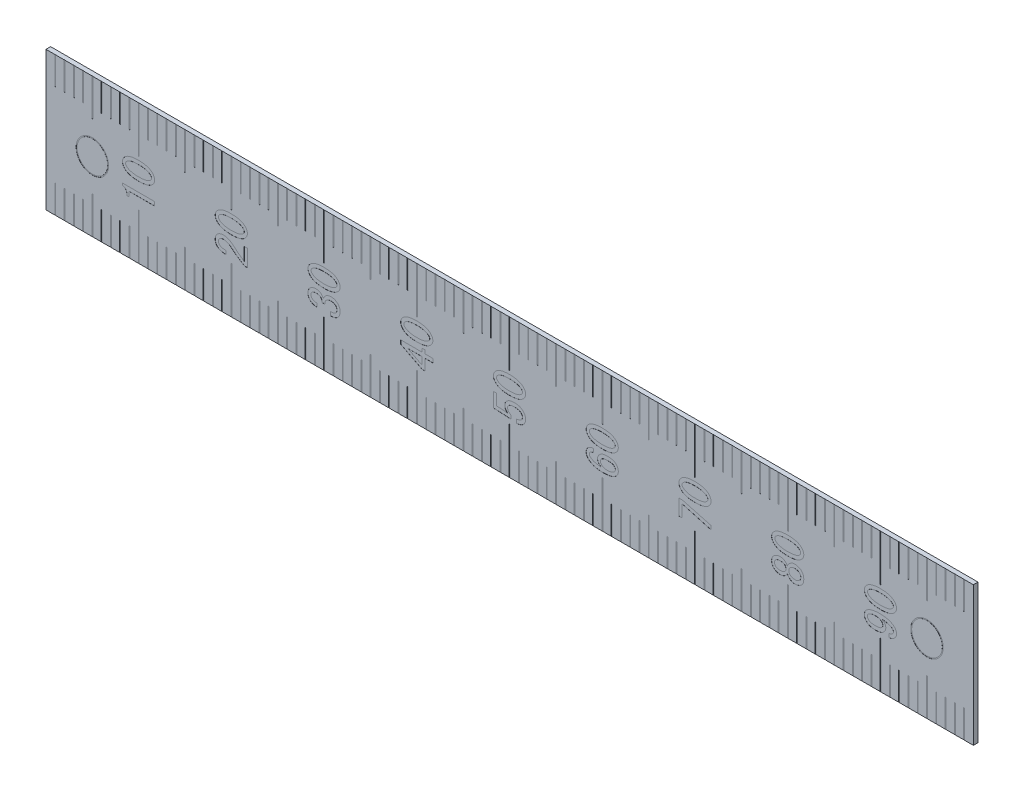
SolidWorks part; units mm, degrees
ref_plane "Front" through (0, 0, 0) normal (0, 0, 1) x (1, 0, 0)
ref_plane "Top" through (0, 0, 0) normal (0, 1, 0) x (1, 0, 0)
ref_plane "Right" through (0, 0, 0) normal (1, 0, 0) x (0, 0, -1)
sketch "Sketch1" plane through (0, 0, 0) normal (0, 0, 1) x (1, 0, 0)
  line L1 (0, -50) -> (0, 50)
  line L2 (0, -50) -> (15, -50)
  line L3 (15, -50) -> (15, 50)
  line L4 (0, 50) -> (15, 50)
  dimension "D1" = 100
  dimension "D2" = 15
extrude "Extrude1" add sketch "Sketch1" along normal blind 0.5
sketch "Sketch2" plane through (0, 0, 0.5) normal (0, 0, 1) x (1, 0, 0)
  line L0 (0, 50) -> (0, -50) construction
  line L1 (0, -50) -> (15, -50) construction
  line L2 (15, 50) -> (0, 50) construction
  circle A0 centre (7.5, -45) radius 1.75
  circle A1 centre (7.5, 45) radius 1.75
  circle A2 centre (7.5, -45) radius 1.65
  circle A3 centre (7.5, 45) radius 1.65
  dimension "D1" = 7.5
  dimension "D2" = 7.5
  dimension "D3" = 5
  dimension "D4" = 5
  dimension "D5" = 3.5
  dimension "D6" = 3.5
  dimension "D7" = 0.1
extrude "Extrude2" cut sketch "Sketch2" against normal blind 0.01
sketch "Sketch3" plane through (0, 0, 0.5) normal (0, 0, 1) x (1, 0, 0)
  line L0 (15, 50) -> (0, 50) construction
  line L1 (5.25, 28.25) -> (9.75, 28.25) construction
  line L2 (5.25, 18.25) -> (9.75, 18.25) construction
  line L3 (5.25, 8.25) -> (9.75, 8.25) construction
  line L5 (0, 50) -> (0, -50) construction
  line L6 (5.25, -1.75) -> (9.75, -1.75) construction
  line L7 (5.25, 38.25) -> (9.75, 38.25) construction
  line L8 (5.25, 38.25) -> (5.25, 41.75) construction
  line L9 (7.5, -50) -> (7.5, 50) construction
  line L10 (0, -50) -> (15, -50) construction
  line L11 (0, 40) -> (15, 40) construction
  line L12 (15, -50) -> (15, 50) construction
  line L13 (5.25, 41.75) -> (9.75, 41.75) construction
  line L14 (9.75, 38.25) -> (9.75, 41.75) construction
  line L15 (5.25, 38.25) -> (9.75, 41.75) construction
  line L16 (5.25, 41.75) -> (9.75, 38.25) construction
  line L17 (5.25, -11.75) -> (9.75, -11.75) construction
  line L18 (5.25, -21.75) -> (9.75, -21.75) construction
  line L19 (5.25, -31.75) -> (9.75, -31.75) construction
  line L20 (5.25, -41.75) -> (9.75, -41.75) construction
  circle A0 centre (7.5, 45) radius 1.75 construction
  text T0 "10" font "ＭＳ ゴシック" height 3.5
  text T1 "20" font "ＭＳ ゴシック" height 3.5
  text T2 "30" font "ＭＳ ゴシック" height 3.5
  text T3 "40" font "ＭＳ ゴシック" height 3.5
  text T4 "50  "
  text T5 "60"
  text T6 "70"
  text T7 "80"
  text T8 "90"
  point P7 (7.5, 40)
  dimension "D2" = 7.5
  dimension "D1" = 4
  dimension "D3" = 6
  dimension "D6" = 10
  dimension "D5" = 4.5
  dimension "D7" = 3.5
extrude "Extrude3" cut sketch "Sketch3" against normal blind 0.01
sketch "Sketch4" plane through (0, 0, 0.5) normal (0, 0, 1) x (1, 0, 0)
  line L0 (15, 40.05) -> (10, 40.05)
  line L1 (15, -50) -> (15, 50) construction
  line L2 (10, 40.05) -> (10, 39.95)
  line L3 (10, 39.95) -> (15, 39.95)
  line L4 (15, 39.95) -> (15, 40.05)
  line L5 (15, 50) -> (0, 50) construction
  line L6 (15, 48.05) -> (15, 47.95)
  line L7 (15, 44.95) -> (11, 44.95)
  line L8 (15, 44.95) -> (15, 45.05)
  line L9 (15, 45.05) -> (11, 45.05)
  line L10 (11, 44.95) -> (11, 45.05)
  line L11 (15, 49.05) -> (12, 49.05)
  line L12 (15, 49.05) -> (15, 48.95)
  line L13 (15, 48.95) -> (12, 48.95)
  line L14 (12, 49.05) -> (12, 48.95)
  line L15 (15, 48.05) -> (12, 48.05)
  line L16 (15, 47.95) -> (12, 47.95)
  line L17 (12, 48.05) -> (12, 47.95)
  line L18 (15, 47.05) -> (15, 46.95)
  line L19 (15, 47.05) -> (12, 47.05)
  line L20 (15, 46.95) -> (12, 46.95)
  line L21 (12, 47.05) -> (12, 46.95)
  line L22 (15, 46.05) -> (15, 45.95)
  line L23 (15, 46.05) -> (12, 46.05)
  line L24 (15, 45.95) -> (12, 45.95)
  line L25 (12, 46.05) -> (12, 45.95)
  line L26 (15, 30.05) -> (10, 30.05)
  line L27 (10, 30.05) -> (10, 29.95)
  line L28 (10, 29.95) -> (15, 29.95)
  line L29 (15, 29.95) -> (15, 30.05)
  line L30 (15, 44.05) -> (15, 43.95)
  line L31 (15, 44.05) -> (12, 44.05)
  line L32 (15, 43.95) -> (12, 43.95)
  line L33 (12, 44.05) -> (12, 43.95)
  line L34 (15, 43.05) -> (15, 42.95)
  line L35 (15, 43.05) -> (12, 43.05)
  line L36 (15, 42.95) -> (12, 42.95)
  line L37 (12, 43.05) -> (12, 42.95)
  line L38 (15, 42.05) -> (15, 41.95)
  line L39 (15, 42.05) -> (12, 42.05)
  line L40 (15, 41.95) -> (12, 41.95)
  line L41 (12, 42.05) -> (12, 41.95)
  line L42 (15, 41.05) -> (15, 40.95)
  line L43 (15, 41.05) -> (12, 41.05)
  line L44 (15, 40.95) -> (12, 40.95)
  line L45 (12, 41.05) -> (12, 40.95)
  line L46 (12, 45.05) -> (12, 44.95)
  line L47 (15, 45.05) -> (12, 45.05)
  line L48 (15, 44.95) -> (12, 44.95)
  line L49 (15, 45.05) -> (15, 44.95)
  line L50 (15, 38.05) -> (15, 37.95)
  line L51 (15, 34.95) -> (11, 34.95)
  line L52 (15, 34.95) -> (15, 35.05)
  line L53 (15, 35.05) -> (11, 35.05)
  line L54 (11, 34.95) -> (11, 35.05)
  line L55 (15, 39.05) -> (12, 39.05)
  line L56 (15, 39.05) -> (15, 38.95)
  line L57 (15, 38.95) -> (12, 38.95)
  line L58 (12, 39.05) -> (12, 38.95)
  line L59 (15, 38.05) -> (12, 38.05)
  line L60 (15, 37.95) -> (12, 37.95)
  line L61 (12, 38.05) -> (12, 37.95)
  line L62 (15, 37.05) -> (15, 36.95)
  line L63 (15, 37.05) -> (12, 37.05)
  line L64 (15, 36.95) -> (12, 36.95)
  line L65 (12, 37.05) -> (12, 36.95)
  line L66 (15, 36.05) -> (15, 35.95)
  line L67 (15, 36.05) -> (12, 36.05)
  line L68 (15, 35.95) -> (12, 35.95)
  line L69 (12, 36.05) -> (12, 35.95)
  line L70 (15, 34.05) -> (15, 33.95)
  line L71 (15, 34.05) -> (12, 34.05)
  line L72 (15, 33.95) -> (12, 33.95)
  line L73 (12, 34.05) -> (12, 33.95)
  line L74 (15, 33.05) -> (15, 32.95)
  line L75 (15, 33.05) -> (12, 33.05)
  line L76 (15, 32.95) -> (12, 32.95)
  line L77 (12, 33.05) -> (12, 32.95)
  line L78 (15, 32.05) -> (15, 31.95)
  line L79 (15, 32.05) -> (12, 32.05)
  line L80 (15, 31.95) -> (12, 31.95)
  line L81 (12, 32.05) -> (12, 31.95)
  line L82 (15, 31.05) -> (15, 30.95)
  line L83 (15, 31.05) -> (12, 31.05)
  line L84 (15, 30.95) -> (12, 30.95)
  line L85 (12, 31.05) -> (12, 30.95)
  line L86 (15, 20.05) -> (10, 20.05)
  line L87 (10, 20.05) -> (10, 19.95)
  line L88 (10, 19.95) -> (15, 19.95)
  line L89 (15, 19.95) -> (15, 20.05)
  line L90 (15, 28.05) -> (15, 27.95)
  line L91 (15, 24.95) -> (11, 24.95)
  line L92 (15, 24.95) -> (15, 25.05)
  line L93 (15, 25.05) -> (11, 25.05)
  line L94 (11, 24.95) -> (11, 25.05)
  line L95 (15, 29.05) -> (12, 29.05)
  line L96 (15, 29.05) -> (15, 28.95)
  line L97 (15, 28.95) -> (12, 28.95)
  line L98 (12, 29.05) -> (12, 28.95)
  line L99 (15, 28.05) -> (12, 28.05)
  line L100 (15, 27.95) -> (12, 27.95)
  line L101 (12, 28.05) -> (12, 27.95)
  line L102 (15, 27.05) -> (15, 26.95)
  line L103 (15, 27.05) -> (12, 27.05)
  line L104 (15, 26.95) -> (12, 26.95)
  line L105 (12, 27.05) -> (12, 26.95)
  line L106 (15, 26.05) -> (15, 25.95)
  line L107 (15, 26.05) -> (12, 26.05)
  line L108 (15, 25.95) -> (12, 25.95)
  line L109 (12, 26.05) -> (12, 25.95)
  line L110 (15, 24.05) -> (15, 23.95)
  line L111 (15, 24.05) -> (12, 24.05)
  line L112 (15, 23.95) -> (12, 23.95)
  line L113 (12, 24.05) -> (12, 23.95)
  line L114 (15, 23.05) -> (15, 22.95)
  line L115 (15, 23.05) -> (12, 23.05)
  line L116 (15, 22.95) -> (12, 22.95)
  line L117 (12, 23.05) -> (12, 22.95)
  line L118 (15, 22.05) -> (15, 21.95)
  line L119 (15, 22.05) -> (12, 22.05)
  line L120 (15, 21.95) -> (12, 21.95)
  line L121 (12, 22.05) -> (12, 21.95)
  line L122 (15, 21.05) -> (15, 20.95)
  line L123 (15, 21.05) -> (12, 21.05)
  line L124 (15, 20.95) -> (12, 20.95)
  line L125 (12, 21.05) -> (12, 20.95)
  line L126 (15, 10.05) -> (10, 10.05)
  line L127 (10, 10.05) -> (10, 9.95)
  line L128 (10, 9.95) -> (15, 9.95)
  line L129 (15, 9.95) -> (15, 10.05)
  line L130 (15, 18.05) -> (15, 17.95)
  line L131 (15, 14.95) -> (11, 14.95)
  line L132 (15, 14.95) -> (15, 15.05)
  line L133 (15, 15.05) -> (11, 15.05)
  line L134 (11, 14.95) -> (11, 15.05)
  line L135 (15, 19.05) -> (12, 19.05)
  line L136 (15, 19.05) -> (15, 18.95)
  line L137 (15, 18.95) -> (12, 18.95)
  line L138 (12, 19.05) -> (12, 18.95)
  line L139 (15, 18.05) -> (12, 18.05)
  line L140 (15, 17.95) -> (12, 17.95)
  line L141 (12, 18.05) -> (12, 17.95)
  line L142 (15, 17.05) -> (15, 16.95)
  line L143 (15, 17.05) -> (12, 17.05)
  line L144 (15, 16.95) -> (12, 16.95)
  line L145 (12, 17.05) -> (12, 16.95)
  line L146 (15, 16.05) -> (15, 15.95)
  line L147 (15, 16.05) -> (12, 16.05)
  line L148 (15, 15.95) -> (12, 15.95)
  line L149 (12, 16.05) -> (12, 15.95)
  line L150 (15, 14.05) -> (15, 13.95)
  line L151 (15, 14.05) -> (12, 14.05)
  line L152 (15, 13.95) -> (12, 13.95)
  line L153 (12, 14.05) -> (12, 13.95)
  line L154 (15, 13.05) -> (15, 12.95)
  line L155 (15, 13.05) -> (12, 13.05)
  line L156 (15, 12.95) -> (12, 12.95)
  line L157 (12, 13.05) -> (12, 12.95)
  line L158 (15, 12.05) -> (15, 11.95)
  line L159 (15, 12.05) -> (12, 12.05)
  line L160 (15, 11.95) -> (12, 11.95)
  line L161 (12, 12.05) -> (12, 11.95)
  line L162 (15, 11.05) -> (15, 10.95)
  line L163 (15, 11.05) -> (12, 11.05)
  line L164 (15, 10.95) -> (12, 10.95)
  line L165 (12, 11.05) -> (12, 10.95)
  line L166 (7.5, 50) -> (7.5, 36.693) construction
  line L167 (3, 1.05) -> (3, 0.95)
  line L168 (0, 0.95) -> (3, 0.95)
  line L169 (0, 1.05) -> (3, 1.05)
  line L170 (15, 8.05) -> (15, 7.95)
  line L171 (15, 4.95) -> (11, 4.95)
  line L172 (15, 4.95) -> (15, 5.05)
  line L173 (15, 5.05) -> (11, 5.05)
  line L174 (11, 4.95) -> (11, 5.05)
  line L175 (15, 9.05) -> (12, 9.05)
  line L176 (15, 9.05) -> (15, 8.95)
  line L177 (15, 8.95) -> (12, 8.95)
  line L178 (12, 9.05) -> (12, 8.95)
  line L179 (15, 8.05) -> (12, 8.05)
  line L180 (15, 7.95) -> (12, 7.95)
  line L181 (12, 8.05) -> (12, 7.95)
  line L182 (15, 7.05) -> (15, 6.95)
  line L183 (15, 7.05) -> (12, 7.05)
  line L184 (15, 6.95) -> (12, 6.95)
  line L185 (12, 7.05) -> (12, 6.95)
  line L186 (15, 6.05) -> (15, 5.95)
  line L187 (15, 6.05) -> (12, 6.05)
  line L188 (15, 5.95) -> (12, 5.95)
  line L189 (12, 6.05) -> (12, 5.95)
  line L190 (15, 4.05) -> (15, 3.95)
  line L191 (15, 4.05) -> (12, 4.05)
  line L192 (15, 3.95) -> (12, 3.95)
  line L193 (12, 4.05) -> (12, 3.95)
  line L194 (15, 3.05) -> (15, 2.95)
  line L195 (15, 3.05) -> (12, 3.05)
  line L196 (15, 2.95) -> (12, 2.95)
  line L197 (12, 3.05) -> (12, 2.95)
  line L198 (15, 2.05) -> (15, 1.95)
  line L199 (15, 2.05) -> (12, 2.05)
  line L200 (15, 1.95) -> (12, 1.95)
  line L201 (12, 2.05) -> (12, 1.95)
  line L202 (15, 1.05) -> (15, 0.95)
  line L203 (15, 1.05) -> (12, 1.05)
  line L204 (15, 0.95) -> (12, 0.95)
  line L205 (12, 1.05) -> (12, 0.95)
  line L206 (15, 0.05) -> (10, 0.05)
  line L207 (10, 0.05) -> (10, -0.05)
  line L208 (10, -0.05) -> (15, -0.05)
  line L209 (15, -0.05) -> (15, 0.05)
  line L210 (0, 1.05) -> (0, 0.95)
  line L211 (3, 2.05) -> (3, 1.95)
  line L212 (0, 1.95) -> (3, 1.95)
  line L213 (0, 2.05) -> (3, 2.05)
  line L214 (0, 2.05) -> (0, 1.95)
  line L215 (3, 3.05) -> (3, 2.95)
  line L216 (0, 2.95) -> (3, 2.95)
  line L217 (0, 3.05) -> (3, 3.05)
  line L218 (0, 3.05) -> (0, 2.95)
  line L219 (3, 4.05) -> (3, 3.95)
  line L220 (0, 3.95) -> (3, 3.95)
  line L221 (0, 4.05) -> (3, 4.05)
  line L222 (0, 4.05) -> (0, 3.95)
  line L223 (3, 6.05) -> (3, 5.95)
  line L224 (0, 5.95) -> (3, 5.95)
  line L225 (0, 6.05) -> (3, 6.05)
  line L226 (0, 6.05) -> (0, 5.95)
  line L227 (3, 7.05) -> (3, 6.95)
  line L228 (0, 6.95) -> (3, 6.95)
  line L229 (0, 7.05) -> (3, 7.05)
  line L230 (0, 7.05) -> (0, 6.95)
  line L231 (3, 8.05) -> (3, 7.95)
  line L232 (0, 7.95) -> (3, 7.95)
  line L233 (0, 8.05) -> (3, 8.05)
  line L234 (3, 9.05) -> (3, 8.95)
  line L235 (0, 8.95) -> (3, 8.95)
  line L236 (0, 9.05) -> (0, 8.95)
  line L237 (0, 9.05) -> (3, 9.05)
  line L238 (4, 4.95) -> (4, 5.05)
  line L239 (0, 5.05) -> (4, 5.05)
  line L240 (0, 4.95) -> (0, 5.05)
  line L241 (0, 4.95) -> (4, 4.95)
  line L242 (0, 8.05) -> (0, 7.95)
  line L243 (3, 11.05) -> (3, 10.95)
  line L244 (0, 10.95) -> (3, 10.95)
  line L245 (0, 11.05) -> (3, 11.05)
  line L246 (0, 11.05) -> (0, 10.95)
  line L247 (3, 12.05) -> (3, 11.95)
  line L248 (0, 11.95) -> (3, 11.95)
  line L249 (0, 12.05) -> (3, 12.05)
  line L250 (0, 12.05) -> (0, 11.95)
  line L251 (3, 13.05) -> (3, 12.95)
  line L252 (0, 12.95) -> (3, 12.95)
  line L253 (0, 13.05) -> (3, 13.05)
  line L254 (0, 13.05) -> (0, 12.95)
  line L255 (3, 14.05) -> (3, 13.95)
  line L256 (0, 13.95) -> (3, 13.95)
  line L257 (0, 14.05) -> (3, 14.05)
  line L258 (0, 14.05) -> (0, 13.95)
  line L259 (3, 16.05) -> (3, 15.95)
  line L260 (0, 15.95) -> (3, 15.95)
  line L261 (0, 16.05) -> (3, 16.05)
  line L262 (0, 16.05) -> (0, 15.95)
  line L263 (3, 17.05) -> (3, 16.95)
  line L264 (0, 16.95) -> (3, 16.95)
  line L265 (0, 17.05) -> (3, 17.05)
  line L266 (0, 17.05) -> (0, 16.95)
  line L267 (3, 18.05) -> (3, 17.95)
  line L268 (0, 17.95) -> (3, 17.95)
  line L269 (0, 18.05) -> (3, 18.05)
  line L270 (3, 19.05) -> (3, 18.95)
  line L271 (0, 18.95) -> (3, 18.95)
  line L272 (0, 19.05) -> (0, 18.95)
  line L273 (0, 19.05) -> (3, 19.05)
  line L274 (4, 14.95) -> (4, 15.05)
  line L275 (0, 15.05) -> (4, 15.05)
  line L276 (0, 14.95) -> (0, 15.05)
  line L277 (0, 14.95) -> (4, 14.95)
  line L278 (0, 18.05) -> (0, 17.95)
  line L279 (0, 9.95) -> (0, 10.05)
  line L280 (5, 9.95) -> (0, 9.95)
  line L281 (5, 10.05) -> (5, 9.95)
  line L282 (0, 10.05) -> (5, 10.05)
  line L283 (3, 21.05) -> (3, 20.95)
  line L284 (0, 20.95) -> (3, 20.95)
  line L285 (0, 21.05) -> (3, 21.05)
  line L286 (0, 21.05) -> (0, 20.95)
  line L287 (3, 22.05) -> (3, 21.95)
  line L288 (0, 21.95) -> (3, 21.95)
  line L289 (0, 22.05) -> (3, 22.05)
  line L290 (0, 22.05) -> (0, 21.95)
  line L291 (3, 23.05) -> (3, 22.95)
  line L292 (0, 22.95) -> (3, 22.95)
  line L293 (0, 23.05) -> (3, 23.05)
  line L294 (0, 23.05) -> (0, 22.95)
  line L295 (3, 24.05) -> (3, 23.95)
  line L296 (0, 23.95) -> (3, 23.95)
  line L297 (0, 24.05) -> (3, 24.05)
  line L298 (0, 24.05) -> (0, 23.95)
  line L299 (3, 26.05) -> (3, 25.95)
  line L300 (0, 25.95) -> (3, 25.95)
  line L301 (0, 26.05) -> (3, 26.05)
  line L302 (0, 26.05) -> (0, 25.95)
  line L303 (3, 27.05) -> (3, 26.95)
  line L304 (0, 26.95) -> (3, 26.95)
  line L305 (0, 27.05) -> (3, 27.05)
  line L306 (0, 27.05) -> (0, 26.95)
  line L307 (3, 28.05) -> (3, 27.95)
  line L308 (0, 27.95) -> (3, 27.95)
  line L309 (0, 28.05) -> (3, 28.05)
  line L310 (3, 29.05) -> (3, 28.95)
  line L311 (0, 28.95) -> (3, 28.95)
  line L312 (0, 29.05) -> (0, 28.95)
  line L313 (0, 29.05) -> (3, 29.05)
  line L314 (4, 24.95) -> (4, 25.05)
  line L315 (0, 25.05) -> (4, 25.05)
  line L316 (0, 24.95) -> (0, 25.05)
  line L317 (0, 24.95) -> (4, 24.95)
  line L318 (0, 28.05) -> (0, 27.95)
  line L319 (0, 19.95) -> (0, 20.05)
  line L320 (5, 19.95) -> (0, 19.95)
  line L321 (5, 20.05) -> (5, 19.95)
  line L322 (0, 20.05) -> (5, 20.05)
  line L323 (3, 31.05) -> (3, 30.95)
  line L324 (0, 30.95) -> (3, 30.95)
  line L325 (0, 31.05) -> (3, 31.05)
  line L326 (0, 31.05) -> (0, 30.95)
  line L327 (3, 32.05) -> (3, 31.95)
  line L328 (0, 31.95) -> (3, 31.95)
  line L329 (0, 32.05) -> (3, 32.05)
  line L330 (0, 32.05) -> (0, 31.95)
  line L331 (3, 33.05) -> (3, 32.95)
  line L332 (0, 32.95) -> (3, 32.95)
  line L333 (0, 33.05) -> (3, 33.05)
  line L334 (0, 33.05) -> (0, 32.95)
  line L335 (3, 34.05) -> (3, 33.95)
  line L336 (0, 33.95) -> (3, 33.95)
  line L337 (0, 34.05) -> (3, 34.05)
  line L338 (0, 34.05) -> (0, 33.95)
  line L339 (3, 36.05) -> (3, 35.95)
  line L340 (0, 35.95) -> (3, 35.95)
  line L341 (0, 36.05) -> (3, 36.05)
  line L342 (0, 36.05) -> (0, 35.95)
  line L343 (3, 37.05) -> (3, 36.95)
  line L344 (0, 36.95) -> (3, 36.95)
  line L345 (0, 37.05) -> (3, 37.05)
  line L346 (0, 37.05) -> (0, 36.95)
  line L347 (3, 38.05) -> (3, 37.95)
  line L348 (0, 37.95) -> (3, 37.95)
  line L349 (0, 38.05) -> (3, 38.05)
  line L350 (3, 39.05) -> (3, 38.95)
  line L351 (0, 38.95) -> (3, 38.95)
  line L352 (0, 39.05) -> (0, 38.95)
  line L353 (0, 39.05) -> (3, 39.05)
  line L354 (4, 34.95) -> (4, 35.05)
  line L355 (0, 35.05) -> (4, 35.05)
  line L356 (0, 34.95) -> (0, 35.05)
  line L357 (0, 34.95) -> (4, 34.95)
  line L358 (0, 38.05) -> (0, 37.95)
  line L359 (3, 41.05) -> (3, 40.95)
  line L360 (0, 40.95) -> (3, 40.95)
  line L361 (0, 41.05) -> (3, 41.05)
  line L362 (0, 41.05) -> (0, 40.95)
  line L363 (3, 42.05) -> (3, 41.95)
  line L364 (0, 41.95) -> (3, 41.95)
  line L365 (0, 42.05) -> (3, 42.05)
  line L366 (0, 42.05) -> (0, 41.95)
  line L367 (3, 43.05) -> (3, 42.95)
  line L368 (0, 42.95) -> (3, 42.95)
  line L369 (0, 43.05) -> (3, 43.05)
  line L370 (0, 43.05) -> (0, 42.95)
  line L371 (3, 44.05) -> (3, 43.95)
  line L372 (0, 43.95) -> (3, 43.95)
  line L373 (0, 44.05) -> (3, 44.05)
  line L374 (0, 44.05) -> (0, 43.95)
  line L375 (0, 29.95) -> (0, 30.05)
  line L376 (5, 29.95) -> (0, 29.95)
  line L377 (5, 30.05) -> (5, 29.95)
  line L378 (0, 30.05) -> (5, 30.05)
  line L379 (3, 46.05) -> (3, 45.95)
  line L380 (0, 45.95) -> (3, 45.95)
  line L381 (0, 46.05) -> (3, 46.05)
  line L382 (0, 46.05) -> (0, 45.95)
  line L383 (3, 47.05) -> (3, 46.95)
  line L384 (0, 46.95) -> (3, 46.95)
  line L385 (0, 47.05) -> (3, 47.05)
  line L386 (0, 47.05) -> (0, 46.95)
  line L387 (3, 48.05) -> (3, 47.95)
  line L388 (0, 47.95) -> (3, 47.95)
  line L389 (0, 48.05) -> (3, 48.05)
  line L390 (3, 49.05) -> (3, 48.95)
  line L391 (0, 48.95) -> (3, 48.95)
  line L392 (0, 49.05) -> (0, 48.95)
  line L393 (0, 49.05) -> (3, 49.05)
  line L394 (4, 44.95) -> (4, 45.05)
  line L395 (0, 45.05) -> (4, 45.05)
  line L396 (0, 44.95) -> (0, 45.05)
  line L397 (0, 44.95) -> (4, 44.95)
  line L398 (0, 48.05) -> (0, 47.95)
  line L399 (0, 39.95) -> (0, 40.05)
  line L400 (5, 39.95) -> (0, 39.95)
  line L401 (5, 40.05) -> (5, 39.95)
  line L402 (0, 40.05) -> (5, 40.05)
  line L403 (15, 0.05) -> (10, 0.05)
  line L404 (10, 0.05) -> (10, -0.05)
  line L405 (10, -0.05) -> (15, -0.05)
  line L406 (15, -0.05) -> (15, 0.05)
  line L407 (3, -8.95) -> (3, -9.05)
  line L408 (0, -9.05) -> (3, -9.05)
  line L409 (0, -8.95) -> (3, -8.95)
  line L410 (15, -1.95) -> (15, -2.05)
  line L411 (15, -5.05) -> (11, -5.05)
  line L412 (15, -5.05) -> (15, -4.95)
  line L413 (15, -4.95) -> (11, -4.95)
  line L414 (11, -5.05) -> (11, -4.95)
  line L415 (15, -0.95) -> (12, -0.95)
  line L416 (15, -0.95) -> (15, -1.05)
  line L417 (15, -1.05) -> (12, -1.05)
  line L418 (12, -0.95) -> (12, -1.05)
  line L419 (15, -1.95) -> (12, -1.95)
  line L420 (15, -2.05) -> (12, -2.05)
  line L421 (12, -1.95) -> (12, -2.05)
  line L422 (15, -2.95) -> (15, -3.05)
  line L423 (15, -2.95) -> (12, -2.95)
  line L424 (15, -3.05) -> (12, -3.05)
  line L425 (12, -2.95) -> (12, -3.05)
  line L426 (15, -3.95) -> (15, -4.05)
  line L427 (15, -3.95) -> (12, -3.95)
  line L428 (15, -4.05) -> (12, -4.05)
  line L429 (12, -3.95) -> (12, -4.05)
  line L430 (15, -5.95) -> (15, -6.05)
  line L431 (15, -5.95) -> (12, -5.95)
  line L432 (15, -6.05) -> (12, -6.05)
  line L433 (12, -5.95) -> (12, -6.05)
  line L434 (15, -6.95) -> (15, -7.05)
  line L435 (15, -6.95) -> (12, -6.95)
  line L436 (15, -7.05) -> (12, -7.05)
  line L437 (12, -6.95) -> (12, -7.05)
  line L438 (15, -7.95) -> (15, -8.05)
  line L439 (15, -7.95) -> (12, -7.95)
  line L440 (15, -8.05) -> (12, -8.05)
  line L441 (12, -7.95) -> (12, -8.05)
  line L442 (15, -8.95) -> (15, -9.05)
  line L443 (15, -8.95) -> (12, -8.95)
  line L444 (15, -9.05) -> (12, -9.05)
  line L445 (12, -8.95) -> (12, -9.05)
  line L446 (0, -8.95) -> (0, -9.05)
  line L447 (3, -7.95) -> (3, -8.05)
  line L448 (0, -8.05) -> (3, -8.05)
  line L449 (0, -7.95) -> (3, -7.95)
  line L450 (0, -7.95) -> (0, -8.05)
  line L451 (3, -6.95) -> (3, -7.05)
  line L452 (0, -7.05) -> (3, -7.05)
  line L453 (0, -6.95) -> (3, -6.95)
  line L454 (0, -6.95) -> (0, -7.05)
  line L455 (3, -5.95) -> (3, -6.05)
  line L456 (0, -6.05) -> (3, -6.05)
  line L457 (0, -5.95) -> (3, -5.95)
  line L458 (0, -5.95) -> (0, -6.05)
  line L459 (3, -3.95) -> (3, -4.05)
  line L460 (0, -4.05) -> (3, -4.05)
  line L461 (0, -3.95) -> (3, -3.95)
  line L462 (0, -3.95) -> (0, -4.05)
  line L463 (3, -2.95) -> (3, -3.05)
  line L464 (0, -3.05) -> (3, -3.05)
  line L465 (0, -2.95) -> (3, -2.95)
  line L466 (0, -2.95) -> (0, -3.05)
  line L467 (3, -1.95) -> (3, -2.05)
  line L468 (0, -2.05) -> (3, -2.05)
  line L469 (0, -1.95) -> (3, -1.95)
  line L470 (3, -0.95) -> (3, -1.05)
  line L471 (0, -1.05) -> (3, -1.05)
  line L472 (0, -0.95) -> (0, -1.05)
  line L473 (0, -0.95) -> (3, -0.95)
  line L474 (4, -5.05) -> (4, -4.95)
  line L475 (0, -4.95) -> (4, -4.95)
  line L476 (0, -5.05) -> (0, -4.95)
  line L477 (0, -5.05) -> (4, -5.05)
  line L478 (0, -1.95) -> (0, -2.05)
  line L479 (0, -0.05) -> (0, 0.05)
  line L480 (5, -0.05) -> (0, -0.05)
  line L481 (5, 0.05) -> (5, -0.05)
  line L482 (0, 0.05) -> (5, 0.05)
  line L483 (15, -9.95) -> (10, -9.95)
  line L484 (10, -9.95) -> (10, -10.05)
  line L485 (10, -10.05) -> (15, -10.05)
  line L486 (15, -10.05) -> (15, -9.95)
  line L487 (3, -18.95) -> (3, -19.05)
  line L488 (0, -19.05) -> (3, -19.05)
  line L489 (0, -18.95) -> (3, -18.95)
  line L490 (15, -11.95) -> (15, -12.05)
  line L491 (15, -15.05) -> (11, -15.05)
  line L492 (15, -15.05) -> (15, -14.95)
  line L493 (15, -14.95) -> (11, -14.95)
  line L494 (11, -15.05) -> (11, -14.95)
  line L495 (15, -10.95) -> (12, -10.95)
  line L496 (15, -10.95) -> (15, -11.05)
  line L497 (15, -11.05) -> (12, -11.05)
  line L498 (12, -10.95) -> (12, -11.05)
  line L499 (15, -11.95) -> (12, -11.95)
  line L500 (15, -12.05) -> (12, -12.05)
  line L501 (12, -11.95) -> (12, -12.05)
  line L502 (15, -12.95) -> (15, -13.05)
  line L503 (15, -12.95) -> (12, -12.95)
  line L504 (15, -13.05) -> (12, -13.05)
  line L505 (12, -12.95) -> (12, -13.05)
  line L506 (15, -13.95) -> (15, -14.05)
  line L507 (15, -13.95) -> (12, -13.95)
  line L508 (15, -14.05) -> (12, -14.05)
  line L509 (12, -13.95) -> (12, -14.05)
  line L510 (15, -15.95) -> (15, -16.05)
  line L511 (15, -15.95) -> (12, -15.95)
  line L512 (15, -16.05) -> (12, -16.05)
  line L513 (12, -15.95) -> (12, -16.05)
  line L514 (15, -16.95) -> (15, -17.05)
  line L515 (15, -16.95) -> (12, -16.95)
  line L516 (15, -17.05) -> (12, -17.05)
  line L517 (12, -16.95) -> (12, -17.05)
  line L518 (15, -17.95) -> (15, -18.05)
  line L519 (15, -17.95) -> (12, -17.95)
  line L520 (15, -18.05) -> (12, -18.05)
  line L521 (12, -17.95) -> (12, -18.05)
  line L522 (15, -18.95) -> (15, -19.05)
  line L523 (15, -18.95) -> (12, -18.95)
  line L524 (15, -19.05) -> (12, -19.05)
  line L525 (12, -18.95) -> (12, -19.05)
  line L526 (0, -18.95) -> (0, -19.05)
  line L527 (3, -17.95) -> (3, -18.05)
  line L528 (0, -18.05) -> (3, -18.05)
  line L529 (0, -17.95) -> (3, -17.95)
  line L530 (0, -17.95) -> (0, -18.05)
  line L531 (3, -16.95) -> (3, -17.05)
  line L532 (0, -17.05) -> (3, -17.05)
  line L533 (0, -16.95) -> (3, -16.95)
  line L534 (0, -16.95) -> (0, -17.05)
  line L535 (3, -15.95) -> (3, -16.05)
  line L536 (0, -16.05) -> (3, -16.05)
  line L537 (0, -15.95) -> (3, -15.95)
  line L538 (0, -15.95) -> (0, -16.05)
  line L539 (3, -13.95) -> (3, -14.05)
  line L540 (0, -14.05) -> (3, -14.05)
  line L541 (0, -13.95) -> (3, -13.95)
  line L542 (0, -13.95) -> (0, -14.05)
  line L543 (3, -12.95) -> (3, -13.05)
  line L544 (0, -13.05) -> (3, -13.05)
  line L545 (0, -12.95) -> (3, -12.95)
  line L546 (0, -12.95) -> (0, -13.05)
  line L547 (3, -11.95) -> (3, -12.05)
  line L548 (0, -12.05) -> (3, -12.05)
  line L549 (0, -11.95) -> (3, -11.95)
  line L550 (3, -10.95) -> (3, -11.05)
  line L551 (0, -11.05) -> (3, -11.05)
  line L552 (0, -10.95) -> (0, -11.05)
  line L553 (0, -10.95) -> (3, -10.95)
  line L554 (4, -15.05) -> (4, -14.95)
  line L555 (0, -14.95) -> (4, -14.95)
  line L556 (0, -15.05) -> (0, -14.95)
  line L557 (0, -15.05) -> (4, -15.05)
  line L558 (0, -11.95) -> (0, -12.05)
  line L559 (0, -10.05) -> (0, -9.95)
  line L560 (5, -10.05) -> (0, -10.05)
  line L561 (5, -9.95) -> (5, -10.05)
  line L562 (0, -9.95) -> (5, -9.95)
  line L563 (15, -19.95) -> (10, -19.95)
  line L564 (10, -19.95) -> (10, -20.05)
  line L565 (10, -20.05) -> (15, -20.05)
  line L566 (15, -20.05) -> (15, -19.95)
  line L567 (3, -28.95) -> (3, -29.05)
  line L568 (0, -29.05) -> (3, -29.05)
  line L569 (0, -28.95) -> (3, -28.95)
  line L570 (15, -21.95) -> (15, -22.05)
  line L571 (15, -25.05) -> (11, -25.05)
  line L572 (15, -25.05) -> (15, -24.95)
  line L573 (15, -24.95) -> (11, -24.95)
  line L574 (11, -25.05) -> (11, -24.95)
  line L575 (15, -20.95) -> (12, -20.95)
  line L576 (15, -20.95) -> (15, -21.05)
  line L577 (15, -21.05) -> (12, -21.05)
  line L578 (12, -20.95) -> (12, -21.05)
  line L579 (15, -21.95) -> (12, -21.95)
  line L580 (15, -22.05) -> (12, -22.05)
  line L581 (12, -21.95) -> (12, -22.05)
  line L582 (15, -22.95) -> (15, -23.05)
  line L583 (15, -22.95) -> (12, -22.95)
  line L584 (15, -23.05) -> (12, -23.05)
  line L585 (12, -22.95) -> (12, -23.05)
  line L586 (15, -23.95) -> (15, -24.05)
  line L587 (15, -23.95) -> (12, -23.95)
  line L588 (15, -24.05) -> (12, -24.05)
  line L589 (12, -23.95) -> (12, -24.05)
  line L590 (15, -25.95) -> (15, -26.05)
  line L591 (15, -25.95) -> (12, -25.95)
  line L592 (15, -26.05) -> (12, -26.05)
  line L593 (12, -25.95) -> (12, -26.05)
  line L594 (15, -26.95) -> (15, -27.05)
  line L595 (15, -26.95) -> (12, -26.95)
  line L596 (15, -27.05) -> (12, -27.05)
  line L597 (12, -26.95) -> (12, -27.05)
  line L598 (15, -27.95) -> (15, -28.05)
  line L599 (15, -27.95) -> (12, -27.95)
  line L600 (15, -28.05) -> (12, -28.05)
  line L601 (12, -27.95) -> (12, -28.05)
  line L602 (15, -28.95) -> (15, -29.05)
  line L603 (15, -28.95) -> (12, -28.95)
  line L604 (15, -29.05) -> (12, -29.05)
  line L605 (12, -28.95) -> (12, -29.05)
  line L606 (0, -28.95) -> (0, -29.05)
  line L607 (3, -27.95) -> (3, -28.05)
  line L608 (0, -28.05) -> (3, -28.05)
  line L609 (0, -27.95) -> (3, -27.95)
  line L610 (0, -27.95) -> (0, -28.05)
  line L611 (3, -26.95) -> (3, -27.05)
  line L612 (0, -27.05) -> (3, -27.05)
  line L613 (0, -26.95) -> (3, -26.95)
  line L614 (0, -26.95) -> (0, -27.05)
  line L615 (3, -25.95) -> (3, -26.05)
  line L616 (0, -26.05) -> (3, -26.05)
  line L617 (0, -25.95) -> (3, -25.95)
  line L618 (0, -25.95) -> (0, -26.05)
  line L619 (3, -23.95) -> (3, -24.05)
  line L620 (0, -24.05) -> (3, -24.05)
  line L621 (0, -23.95) -> (3, -23.95)
  line L622 (0, -23.95) -> (0, -24.05)
  line L623 (3, -22.95) -> (3, -23.05)
  line L624 (0, -23.05) -> (3, -23.05)
  line L625 (0, -22.95) -> (3, -22.95)
  line L626 (0, -22.95) -> (0, -23.05)
  line L627 (3, -21.95) -> (3, -22.05)
  line L628 (0, -22.05) -> (3, -22.05)
  line L629 (0, -21.95) -> (3, -21.95)
  line L630 (3, -20.95) -> (3, -21.05)
  line L631 (0, -21.05) -> (3, -21.05)
  line L632 (0, -20.95) -> (0, -21.05)
  line L633 (0, -20.95) -> (3, -20.95)
  line L634 (4, -25.05) -> (4, -24.95)
  line L635 (0, -24.95) -> (4, -24.95)
  line L636 (0, -25.05) -> (0, -24.95)
  line L637 (0, -25.05) -> (4, -25.05)
  line L638 (0, -21.95) -> (0, -22.05)
  line L639 (0, -20.05) -> (0, -19.95)
  line L640 (5, -20.05) -> (0, -20.05)
  line L641 (5, -19.95) -> (5, -20.05)
  line L642 (0, -19.95) -> (5, -19.95)
  line L643 (15, -29.95) -> (10, -29.95)
  line L644 (10, -29.95) -> (10, -30.05)
  line L645 (10, -30.05) -> (15, -30.05)
  line L646 (15, -30.05) -> (15, -29.95)
  line L647 (3, -38.95) -> (3, -39.05)
  line L648 (0, -39.05) -> (3, -39.05)
  line L649 (0, -38.95) -> (3, -38.95)
  line L650 (15, -31.95) -> (15, -32.05)
  line L651 (15, -35.05) -> (11, -35.05)
  line L652 (15, -35.05) -> (15, -34.95)
  line L653 (15, -34.95) -> (11, -34.95)
  line L654 (11, -35.05) -> (11, -34.95)
  line L655 (15, -30.95) -> (12, -30.95)
  line L656 (15, -30.95) -> (15, -31.05)
  line L657 (15, -31.05) -> (12, -31.05)
  line L658 (12, -30.95) -> (12, -31.05)
  line L659 (15, -31.95) -> (12, -31.95)
  line L660 (15, -32.05) -> (12, -32.05)
  line L661 (12, -31.95) -> (12, -32.05)
  line L662 (15, -32.95) -> (15, -33.05)
  line L663 (15, -32.95) -> (12, -32.95)
  line L664 (15, -33.05) -> (12, -33.05)
  line L665 (12, -32.95) -> (12, -33.05)
  line L666 (15, -33.95) -> (15, -34.05)
  line L667 (15, -33.95) -> (12, -33.95)
  line L668 (15, -34.05) -> (12, -34.05)
  line L669 (12, -33.95) -> (12, -34.05)
  line L670 (15, -35.95) -> (15, -36.05)
  line L671 (15, -35.95) -> (12, -35.95)
  line L672 (15, -36.05) -> (12, -36.05)
  line L673 (12, -35.95) -> (12, -36.05)
  line L674 (15, -36.95) -> (15, -37.05)
  line L675 (15, -36.95) -> (12, -36.95)
  line L676 (15, -37.05) -> (12, -37.05)
  line L677 (12, -36.95) -> (12, -37.05)
  line L678 (15, -37.95) -> (15, -38.05)
  line L679 (15, -37.95) -> (12, -37.95)
  line L680 (15, -38.05) -> (12, -38.05)
  line L681 (12, -37.95) -> (12, -38.05)
  line L682 (15, -38.95) -> (15, -39.05)
  line L683 (15, -38.95) -> (12, -38.95)
  line L684 (15, -39.05) -> (12, -39.05)
  line L685 (12, -38.95) -> (12, -39.05)
  line L686 (0, -38.95) -> (0, -39.05)
  line L687 (3, -37.95) -> (3, -38.05)
  line L688 (0, -38.05) -> (3, -38.05)
  line L689 (0, -37.95) -> (3, -37.95)
  line L690 (0, -37.95) -> (0, -38.05)
  line L691 (3, -36.95) -> (3, -37.05)
  line L692 (0, -37.05) -> (3, -37.05)
  line L693 (0, -36.95) -> (3, -36.95)
  line L694 (0, -36.95) -> (0, -37.05)
  line L695 (3, -35.95) -> (3, -36.05)
  line L696 (0, -36.05) -> (3, -36.05)
  line L697 (0, -35.95) -> (3, -35.95)
  line L698 (0, -35.95) -> (0, -36.05)
  line L699 (3, -33.95) -> (3, -34.05)
  line L700 (0, -34.05) -> (3, -34.05)
  line L701 (0, -33.95) -> (3, -33.95)
  line L702 (0, -33.95) -> (0, -34.05)
  line L703 (3, -32.95) -> (3, -33.05)
  line L704 (0, -33.05) -> (3, -33.05)
  line L705 (0, -32.95) -> (3, -32.95)
  line L706 (0, -32.95) -> (0, -33.05)
  line L707 (3, -31.95) -> (3, -32.05)
  line L708 (0, -32.05) -> (3, -32.05)
  line L709 (0, -31.95) -> (3, -31.95)
  line L710 (3, -30.95) -> (3, -31.05)
  line L711 (0, -31.05) -> (3, -31.05)
  line L712 (0, -30.95) -> (0, -31.05)
  line L713 (0, -30.95) -> (3, -30.95)
  line L714 (4, -35.05) -> (4, -34.95)
  line L715 (0, -34.95) -> (4, -34.95)
  line L716 (0, -35.05) -> (0, -34.95)
  line L717 (0, -35.05) -> (4, -35.05)
  line L718 (0, -31.95) -> (0, -32.05)
  line L719 (0, -30.05) -> (0, -29.95)
  line L720 (5, -30.05) -> (0, -30.05)
  line L721 (5, -29.95) -> (5, -30.05)
  line L722 (0, -29.95) -> (5, -29.95)
  line L723 (15, -39.95) -> (10, -39.95)
  line L724 (10, -39.95) -> (10, -40.05)
  line L725 (10, -40.05) -> (15, -40.05)
  line L726 (15, -40.05) -> (15, -39.95)
  line L727 (3, -48.95) -> (3, -49.05)
  line L728 (0, -49.05) -> (3, -49.05)
  line L729 (0, -48.95) -> (3, -48.95)
  line L730 (15, -41.95) -> (15, -42.05)
  line L731 (15, -45.05) -> (11, -45.05)
  line L732 (15, -45.05) -> (15, -44.95)
  line L733 (15, -44.95) -> (11, -44.95)
  line L734 (11, -45.05) -> (11, -44.95)
  line L735 (15, -40.95) -> (12, -40.95)
  line L736 (15, -40.95) -> (15, -41.05)
  line L737 (15, -41.05) -> (12, -41.05)
  line L738 (12, -40.95) -> (12, -41.05)
  line L739 (15, -41.95) -> (12, -41.95)
  line L740 (15, -42.05) -> (12, -42.05)
  line L741 (12, -41.95) -> (12, -42.05)
  line L742 (15, -42.95) -> (15, -43.05)
  line L743 (15, -42.95) -> (12, -42.95)
  line L744 (15, -43.05) -> (12, -43.05)
  line L745 (12, -42.95) -> (12, -43.05)
  line L746 (15, -43.95) -> (15, -44.05)
  line L747 (15, -43.95) -> (12, -43.95)
  line L748 (15, -44.05) -> (12, -44.05)
  line L749 (12, -43.95) -> (12, -44.05)
  line L750 (15, -45.95) -> (15, -46.05)
  line L751 (15, -45.95) -> (12, -45.95)
  line L752 (15, -46.05) -> (12, -46.05)
  line L753 (12, -45.95) -> (12, -46.05)
  line L754 (15, -46.95) -> (15, -47.05)
  line L755 (15, -46.95) -> (12, -46.95)
  line L756 (15, -47.05) -> (12, -47.05)
  line L757 (12, -46.95) -> (12, -47.05)
  line L758 (15, -47.95) -> (15, -48.05)
  line L759 (15, -47.95) -> (12, -47.95)
  line L760 (15, -48.05) -> (12, -48.05)
  line L761 (12, -47.95) -> (12, -48.05)
  line L762 (15, -48.95) -> (15, -49.05)
  line L763 (15, -48.95) -> (12, -48.95)
  line L764 (15, -49.05) -> (12, -49.05)
  line L765 (12, -48.95) -> (12, -49.05)
  line L766 (0, -48.95) -> (0, -49.05)
  line L767 (3, -47.95) -> (3, -48.05)
  line L768 (0, -48.05) -> (3, -48.05)
  line L769 (0, -47.95) -> (3, -47.95)
  line L770 (0, -47.95) -> (0, -48.05)
  line L771 (3, -46.95) -> (3, -47.05)
  line L772 (0, -47.05) -> (3, -47.05)
  line L773 (0, -46.95) -> (3, -46.95)
  line L774 (0, -46.95) -> (0, -47.05)
  line L775 (3, -45.95) -> (3, -46.05)
  line L776 (0, -46.05) -> (3, -46.05)
  line L777 (0, -45.95) -> (3, -45.95)
  line L778 (0, -45.95) -> (0, -46.05)
  line L779 (3, -43.95) -> (3, -44.05)
  line L780 (0, -44.05) -> (3, -44.05)
  line L781 (0, -43.95) -> (3, -43.95)
  line L782 (0, -43.95) -> (0, -44.05)
  line L783 (3, -42.95) -> (3, -43.05)
  line L784 (0, -43.05) -> (3, -43.05)
  line L785 (0, -42.95) -> (3, -42.95)
  line L786 (0, -42.95) -> (0, -43.05)
  line L787 (3, -41.95) -> (3, -42.05)
  line L788 (0, -42.05) -> (3, -42.05)
  line L789 (0, -41.95) -> (3, -41.95)
  line L790 (3, -40.95) -> (3, -41.05)
  line L791 (0, -41.05) -> (3, -41.05)
  line L792 (0, -40.95) -> (0, -41.05)
  line L793 (0, -40.95) -> (3, -40.95)
  line L794 (4, -45.05) -> (4, -44.95)
  line L795 (0, -44.95) -> (4, -44.95)
  line L796 (0, -45.05) -> (0, -44.95)
  line L797 (0, -45.05) -> (4, -45.05)
  line L798 (0, -41.95) -> (0, -42.05)
  line L799 (0, -40.05) -> (0, -39.95)
  line L800 (5, -40.05) -> (0, -40.05)
  line L801 (5, -39.95) -> (5, -40.05)
  line L802 (0, -39.95) -> (5, -39.95)
  point P4 (15, 40)
  point P13 (15, 45)
  point P18 (15, 49)
  dimension "D1" = 10
  dimension "D2" = 0.1
  dimension "D3" = 5
  dimension "D4" = 5
  dimension "D5" = 0.1
  dimension "D6" = 1
  dimension "D7" = 0.1
  dimension "D8" = 3
  dimension "D9" = 4
  dimension "D12" = 6
  dimension "D10" = 9
  dimension "D11" = 5
extrude "Extrude4" cut sketch "Sketch4" against normal blind 0.01
move or copy body "Body-Move/Copy2" bodies to move or copy 105 copy no rotation origin (0, 0, 0) rotation axis (0, 0, 1) rotation angle 90
move or copy body "Body-Move/Copy3" bodies to move or copy 107 copy no translate (50, -7.5, 0)
